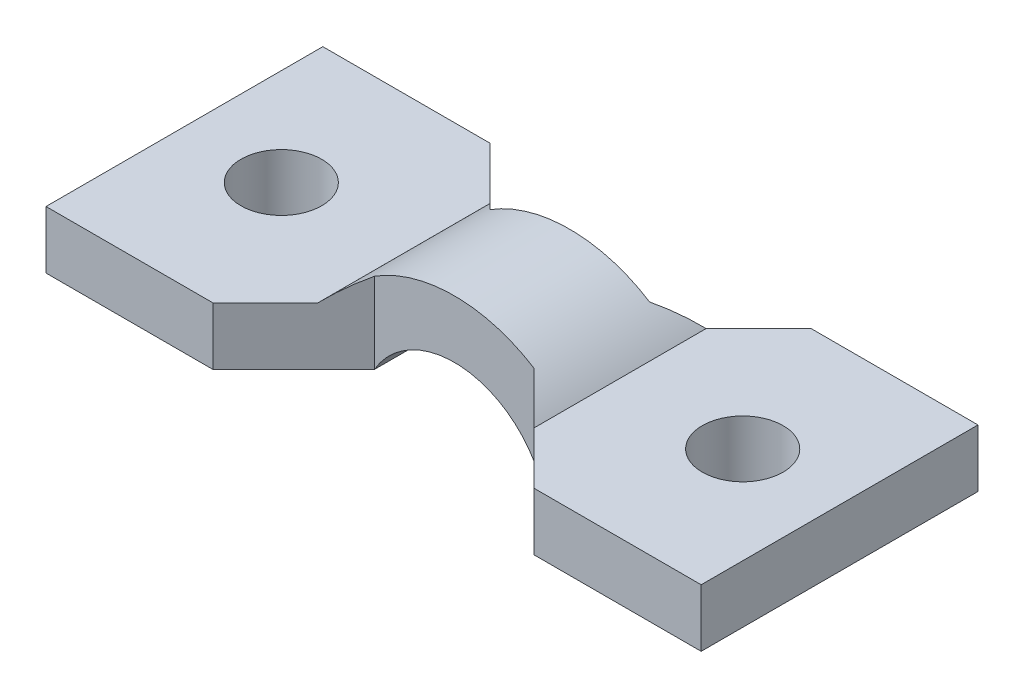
SolidWorks part; units mm, degrees
ref_plane "Front Plane" through (0, 0, 0) normal (0, 0, 1) x (1, 0, 0)
ref_plane "Top Plane" through (0, 0, 0) normal (0, 1, 0) x (1, 0, 0)
ref_plane "Right Plane" through (0, 0, 0) normal (1, 0, 0) x (0, 0, -1)
sketch "Sketch1" plane through (0, 0, 0) normal (0, 0, 1) x (1, 0, 0)
  line L0 (-3.4641, 2) -> (-14.2, 2)
  line L1 (0, 0) -> (0, -6.8313) construction
  line L2 (3.4641, 2) -> (14.2, 2)
  line L3 (4.6904, 4.5) -> (14.2, 4.5)
  line L4 (-4.6904, 4.5) -> (-14.2, 4.5)
  line L5 (-14.2, 4.5) -> (-14.2, 2)
  line L6 (14.2, 4.5) -> (14.2, 2)
  arc A0 (3.4641, 2) -> (-3.4641, 2) centre (0, 0) ccw
  arc A1 (4.6904, 4.5) -> (-4.6904, 4.5) centre (0, 0) ccw
  dimension "D1" = 8
  dimension "D2" = 2
  dimension "D3" = 28.4
  dimension "D4" = 2.5
extrude "Boss-Extrude1" add sketch "Sketch1" along normal blind 12
sketch "Sketch2" plane through (0, 4.5, 0) normal (0, 1, 0) x (1, 0, 0)
  line L0 (-14.2, -6) -> (14.2, -6) construction
  line L1 (-14.2, -12) -> (-14.2, 0) construction
  line L2 (14.2, -12) -> (14.2, 0) construction
  line L3 (10, -6) -> (-10, -6) construction
  circle A0 centre (-10, -6) radius 1.75
  circle A1 centre (10, -6) radius 1.75
  point P9 (0, -6)
  dimension "D2" = 3.5
  dimension "D3" = 3.5
  dimension "D1" = 20
extrude "Cut-Extrude1" cut sketch "Sketch2" against normal through all
sketch "Sketch4" plane through (0, 2, 0) normal (0, -1, 0) x (1, 0, 0)
  line L0 (3.4641, 12) -> (3.4641, 0) construction
  line L1 (-3.4641, 12) -> (3.4641, 12)
  line L2 (-3.4641, 12) -> (-3.4641, 8.5)
  line L3 (-3.4641, 8.5) -> (3.4641, 8.5)
  line L4 (3.4641, 12) -> (3.4641, 8.5)
  line L5 (-3.4641, 3.5) -> (-6.9641, 0)
  line L6 (-3.4641, 0) -> (3.4641, 0)
  line L7 (-3.4641, 0) -> (-3.4641, 3.5)
  line L8 (-3.4641, 3.5) -> (3.4641, 3.5)
  line L9 (3.4641, 0) -> (3.4641, 3.5)
  line L10 (-14.2, 0) -> (-3.4641, 0) construction
  line L11 (-6.9641, 0) -> (3.4641, 0)
  line L12 (3.4641, 3.5) -> (6.9641, 0)
  line L13 (3.4641, 0) -> (14.2, 0) construction
  line L14 (6.9641, 0) -> (3.4641, 0)
  line L15 (-3.4641, 8.5) -> (-6.9641, 12)
  line L16 (-14.2, 12) -> (-3.4641, 12) construction
  line L17 (-6.9641, 12) -> (-3.4641, 12)
  line L18 (3.4641, 8.5) -> (6.9641, 12)
  line L19 (3.4641, 12) -> (14.2, 12) construction
  line L20 (6.9641, 12) -> (3.4641, 12)
  dimension "D1" = 3.5
  dimension "D2" = 3.5
  dimension "D3" = 45
  dimension "D4" = 45
extrude "Cut-Extrude2" cut sketch "Sketch4" against normal through all contours L14 L12 L9 | L6 L9 L8 M13 | L5 M13 M12 | L15 M13 M14 | L4 L1 L3 M13 | L18 L20 L4
